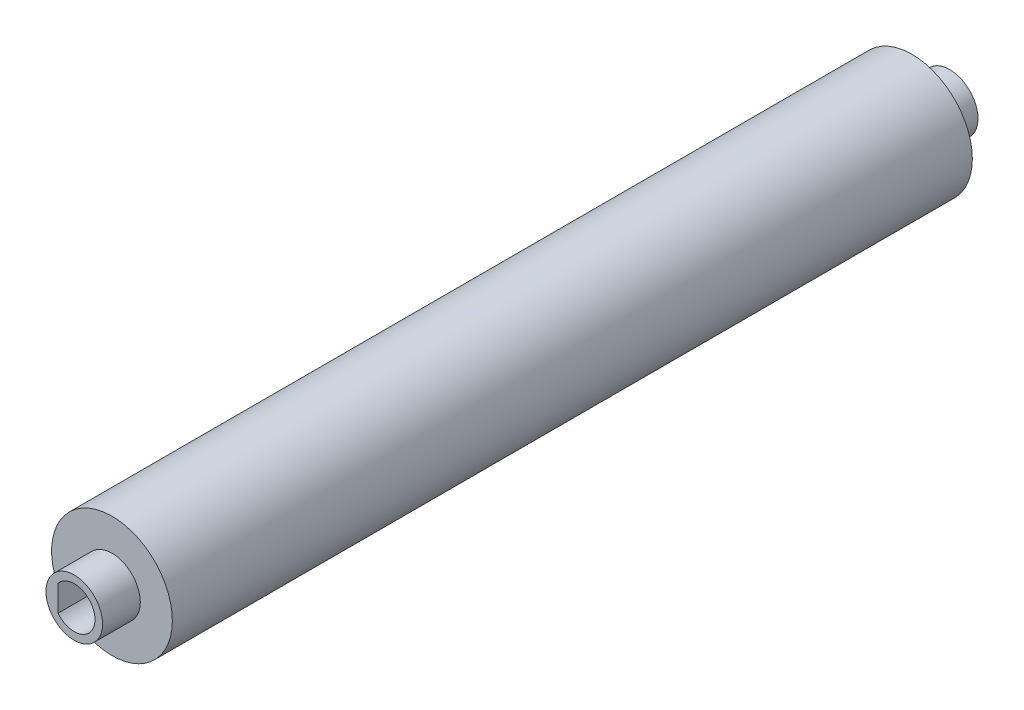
SolidWorks part; units mm, degrees
ref_plane "Front Plane" through (0, 0, 0) normal (0, 0, 1) x (1, 0, 0)
ref_plane "Top Plane" through (0, 0, 0) normal (0, 1, 0) x (1, 0, 0)
ref_plane "Right Plane" through (0, 0, 0) normal (1, 0, 0) x (0, 0, -1)
sketch "Croquis1" plane through (0, 0, 0) normal (0, 0, 1) x (1, 0, 0)
  circle A0 centre (0, 0) radius 8
  dimension "D1" = 16
extrude "Saliente-Extruir1" add sketch "Croquis1" along normal blind 106
sketch "Croquis2" plane through (0, 0, 106) normal (0, 0, 1) x (1, 0, 0)
  circle A0 centre (0, 0) radius 3.75
  dimension "D1" = 7.5
extrude "Saliente-Extruir2" add sketch "Croquis2" along normal blind 5 and the other way blind 111 contours A0
sketch "Croquis3" plane through (0, 0, 111) normal (0, 0, 1) x (1, 0, 0)
  line L1 (-2.15, 1.7146) -> (-2.15, -1.7146)
  arc A1 (-2.15, -1.7146) -> (-2.15, 1.7146) centre (0, 0) ccw
  point P1 (2.75, 0)
  dimension "D1" = 5.5
  dimension "D2" = 4.9
extrude "Cortar-Extruir2" cut sketch "Croquis3" against normal blind 21
